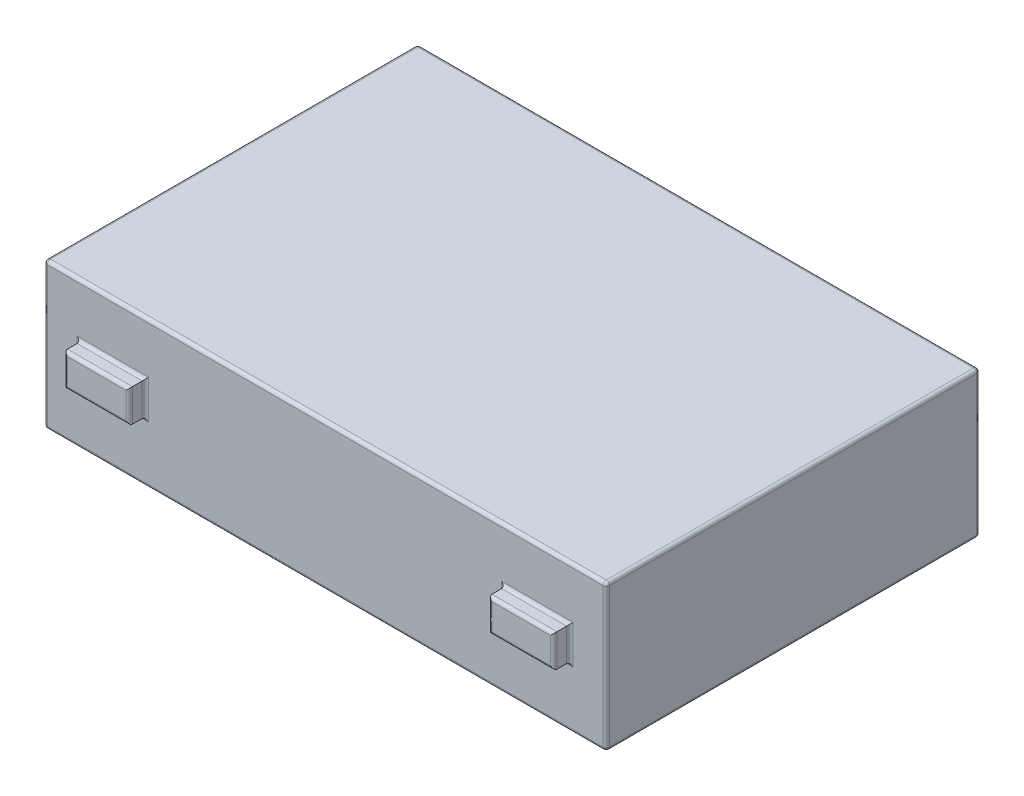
SolidWorks part; units mm, degrees
ref_plane "Front Plane" through (0, 0, 0) normal (0, 0, 1) x (1, 0, 0)
ref_plane "Top Plane" through (0, 0, 0) normal (0, 1, 0) x (1, 0, 0)
ref_plane "Right Plane" through (0, 0, 0) normal (1, 0, 0) x (0, 0, -1)
sketch "Sketch1" plane through (0, 0, 0) normal (0, 0, 1) x (1, 0, 0)
  line L1 (86.5, -22.5) -> (-86.5, -22.5)
  line L2 (86.5, -22.5) -> (86.5, 22.5)
  line L3 (86.5, 22.5) -> (-86.5, 22.5)
  line L4 (-86.5, -22.5) -> (-86.5, 22.5)
  line L5 (-86.5, 0) -> (86.5, 0) construction
  line L7 (0, 22.5) -> (0, -22.5) construction
  point P8 (0, 0)
  dimension "D1" = 173
  dimension "D2" = 45
extrude "Boss-Extrude1" add sketch "Sketch1" along normal blind 115
sketch "Sketch2" plane through (0, 0, 115) normal (0, 0, 1) x (1, 0, 0)
  line L0 (-86.5, 0) -> (86.5, 0) construction
  line L1 (-86.5, 22.5) -> (-86.5, -22.5) construction
  line L2 (86.5, -22.5) -> (86.5, 22.5) construction
  line L3 (0, 22.5) -> (0, -22.5) construction
  line L4 (-75.3189, 6.1178) -> (-55.3189, 6.1178)
  line L5 (-75.3189, 6.1178) -> (-75.3189, -3.8822)
  line L6 (-75.3189, -3.8822) -> (-55.3189, -3.8822)
  line L7 (-55.3189, 6.1178) -> (-55.3189, -3.8822)
  line L8 (86.5, 22.5) -> (-86.5, 22.5) construction
  line L9 (-86.5, -22.5) -> (86.5, -22.5) construction
  line L10 (75.3189, -3.8822) -> (55.3189, -3.8822)
  line L11 (55.3189, 6.1178) -> (55.3189, -3.8822)
  line L12 (75.3189, 6.1178) -> (55.3189, 6.1178)
  line L13 (75.3189, 6.1178) -> (75.3189, -3.8822)
  dimension "D1" = 20
  dimension "D2" = 10
  dimension "D3" = 55.3189
  dimension "D4" = 16.3822
extrude "Boss-Extrude2" add sketch "Sketch2" along normal blind 5
fillet "Fillet1" radius 1 28 edges at (-65.3189, 6.1178, 120) (-55.3189, 1.1178, 120) (-65.3189, -3.8822, 120) (-75.3189, 1.1178, 120) (-86.5, 0, 0) (-86.5, -22.5, 57.5) (0, -22.5, 0) (86.5, -22.5, 57.5) (86.5, 0, 0) (86.5, 22.5, 57.5) (-86.5, 22.5, 57.5) (0, 22.5, 0) (55.3189, 1.1178, 115) (65.3189, -3.8822, 115) (75.3189, 1.1178, 115) (65.3189, 6.1178, 115) (-55.3189, 1.1178, 115) (-65.3189, 6.1178, 115) (-75.3189, 1.1178, 115) (-65.3189, -3.8822, 115) (0, -22.5, 115) (-86.5, 0, 115) (0, 22.5, 115) (86.5, 0, 115) (55.3189, 1.1178, 120) (65.3189, -3.8822, 120) (65.3189, 6.1178, 120) (75.3189, 1.1178, 120)
